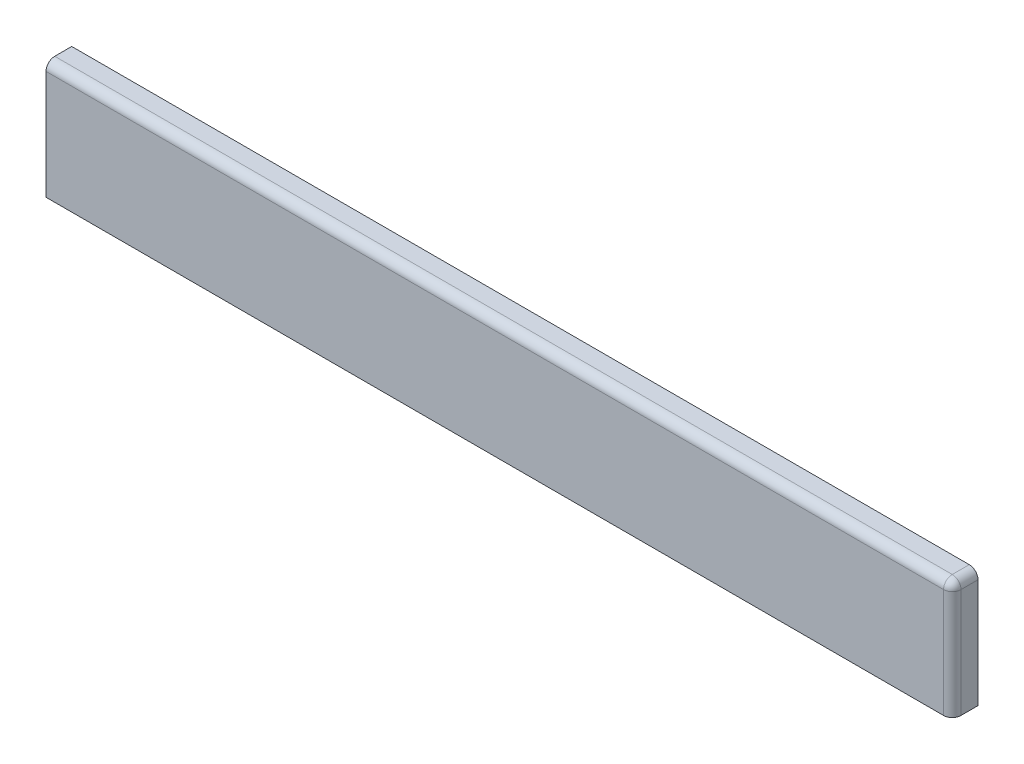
SolidWorks part; units mm, degrees
ref_plane "Спереди" through (0, 0, 0) normal (0, 0, 1) x (1, 0, 0)
ref_plane "Сверху" through (0, 0, 0) normal (0, 1, 0) x (1, 0, 0)
ref_plane "Справа" through (0, 0, 0) normal (1, 0, 0) x (0, 0, -1)
sketch "Эскиз1" plane through (0, 0, 0) normal (0, 0, 1) x (1, 0, 0)
  line L0 (929, -113) -> (479, -113) construction
  line L1 (-1009, 0) -> (1009, 0)
  line L2 (-1009, 0) -> (-1009, -270)
  line L3 (-1009, -270) -> (1009, -270)
  line L4 (1009, 0) -> (1009, -270)
  line L5 (0, -270) -> (0, 0) construction
  line L6 (479, -113) -> (29, -113) construction
  line L7 (897.5, -255) -> (299.1667, -255) construction
  line L8 (299.1667, -255) -> (-299.1667, -255) construction
  line L9 (-299.1667, -255) -> (-897.5, -255) construction
  circle A0 centre (929, -113) radius 5
  circle A1 centre (29, -113) radius 5
  circle A4 centre (479, -113) radius 5
  circle A9 centre (976, -160) radius 5
  circle A10 centre (976, -240) radius 5
  circle A11 centre (-976, -240) radius 5
  circle A12 centre (-976, -160) radius 5
  circle A13 centre (-897.5, -255) radius 5
  circle A14 centre (-299.1667, -255) radius 5
  circle A15 centre (299.1667, -255) radius 5
  circle A16 centre (897.5, -255) radius 5
  dimension "D3" = 10
  dimension "D6" = 80
  dimension "D7" = 30
  dimension "D12" = 111.5
  dimension "D1" = 270
  dimension "D2" = 2018
  dimension "D4" = 80
  dimension "D5" = 157
  dimension "D8" = 33
  dimension "D9" = 450
  dimension "D10" = 15
  dimension "D11" = 111.5
extrude "Бобышка-Вытянуть1" add sketch "Эскиз1" along normal blind 16
sketch "Эскиз2" plane through (0, 0, 0) normal (0, 0, -1) x (-1, 0, 0)
  line L1 (764, -142) -> (174.0848, -132) construction
  line L2 (764, -142) -> (762.9831, -201.9914) construction
  line L3 (762.9831, -201.9914) -> (173.0678, -191.9914) construction
  line L4 (174.0848, -132) -> (173.0678, -191.9914) construction
  line L6 (1009, 0) -> (1009, -270) construction
  circle A0 centre (173.0678, -191.9914) radius 5
  circle A1 centre (174.0848, -132) radius 5
  circle A2 centre (764, -142) radius 5
  circle A3 centre (762.9831, -201.9914) radius 5
  circle A5 centre (-29, -113) radius 5 construction
  dimension "D1" = 10
  dimension "D4" = 10
  dimension "D5" = 245
  dimension "D6" = 19
  dimension "D2" = 60
  dimension "D3" = 590
extrude "Вырез-Вытянуть1" cut sketch "Эскиз2" against normal through all
other "Переместить грань1" [suppressed] parameters "D1"=15
sketch "Эскиз3" plane through (0, 0, 0) normal (0, 0, -1) x (-1, 0, 0)
  line L4 (1009, -270) -> (1009, 0)
  line L5 (1009, 0) -> (-1009, 0)
  line L6 (-1009, 0) -> (-1009, -270)
  line L7 (-1009, -270) -> (1009, -270)
  line L8 (1009, -270) -> (1009, 0)
  line L9 (1009, 0) -> (-1009, 0)
  line L10 (-1009, 0) -> (-1009, -270)
  line L11 (-1009, -270) -> (1009, -270)
  dimension "D1" = 0
extrude "Бобышка-Вытянуть2" add sketch "Эскиз3" against normal blind 43 from offset 16
fillet "Скругление1" radius 20 1 edges at (0, 0, 59)
other "Переместить грань2" parameters "D1"=60
fillet "Скругление2" radius 20 3 edges at (1069, 0, 19.5) (1069, -5.8579, 53.1421) (1069, -145, 59)
